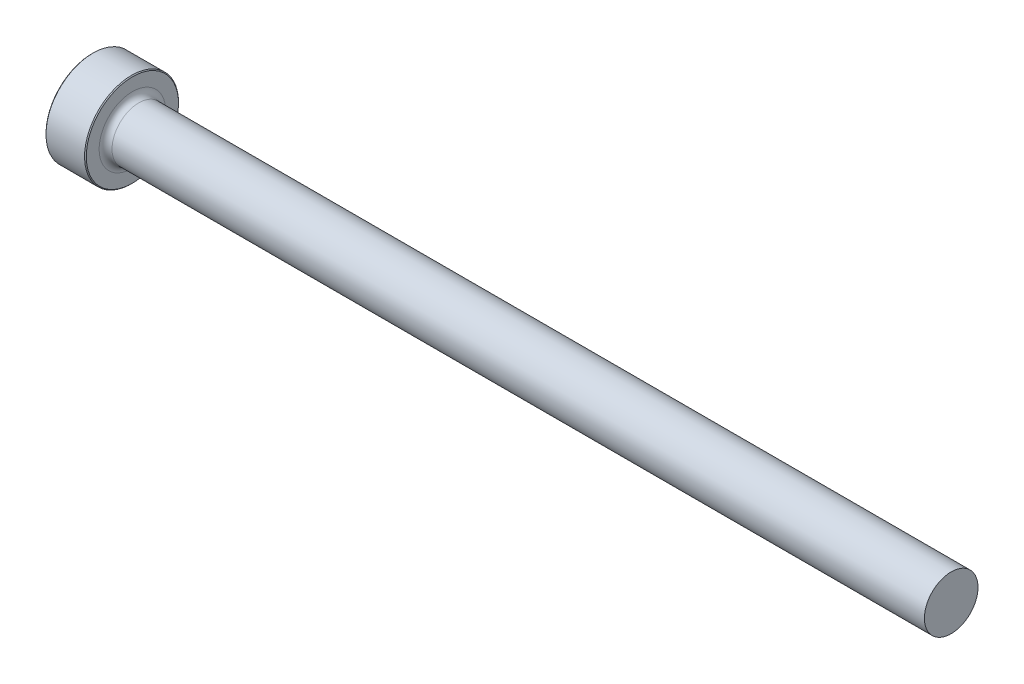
SolidWorks part; units mm, degrees
ref_plane "Front Plane" through (0, 0, 0) normal (0, 0, 1) x (1, 0, 0)
ref_plane "Top Plane" through (0, 0, 0) normal (0, 1, 0) x (1, 0, 0)
ref_plane "Right Plane" through (0, 0, 0) normal (1, 0, 0) x (0, 0, -1)
sketch "Sketch1" plane through (0, 0, 0) normal (0, 0, 1) x (1, 0, 0)
  line L0 (0, 0) -> (0, 5.5562)
  line L1 (0, 5.5562) -> (4.7625, 5.5562)
  line L2 (4.7625, 5.5562) -> (4.7625, 3.9332)
  line L3 (5.5245, 3.1712) -> (101.6, 3.1712)
  line L4 (101.6, 3.1712) -> (101.6, 0)
  line L5 (101.6, 0) -> (0, 0)
  line L6 (101.6, 0) -> (101.6, -3.1712) construction
  line L7 (101.6, -3.1712) -> (4.7625, -3.1712) construction
  line L8 (0, 0) -> (0, -5.5562) construction
  line L9 (0, -5.5562) -> (4.7625, -5.5562) construction
  line L10 (4.7625, -5.5562) -> (4.7625, -3.1712) construction
  arc A0 (4.7625, 3.9332) -> (5.5245, 3.1712) centre (5.5245, 3.9332) ccw
  dimension "D4" = 0.762
  dimension "L" = 101.6
  dimension "D" = 6.3424
  dimension "H" = 11.1125
  dimension "T" = 4.7625
revolve "Revolve1" add sketch "Sketch1" angle 360 about L5
chamfer "Chamfer1" distance 0.1016 angle 45 2 edges at (0, 5.5562, 0) (4.7625, 5.5562, 0)
